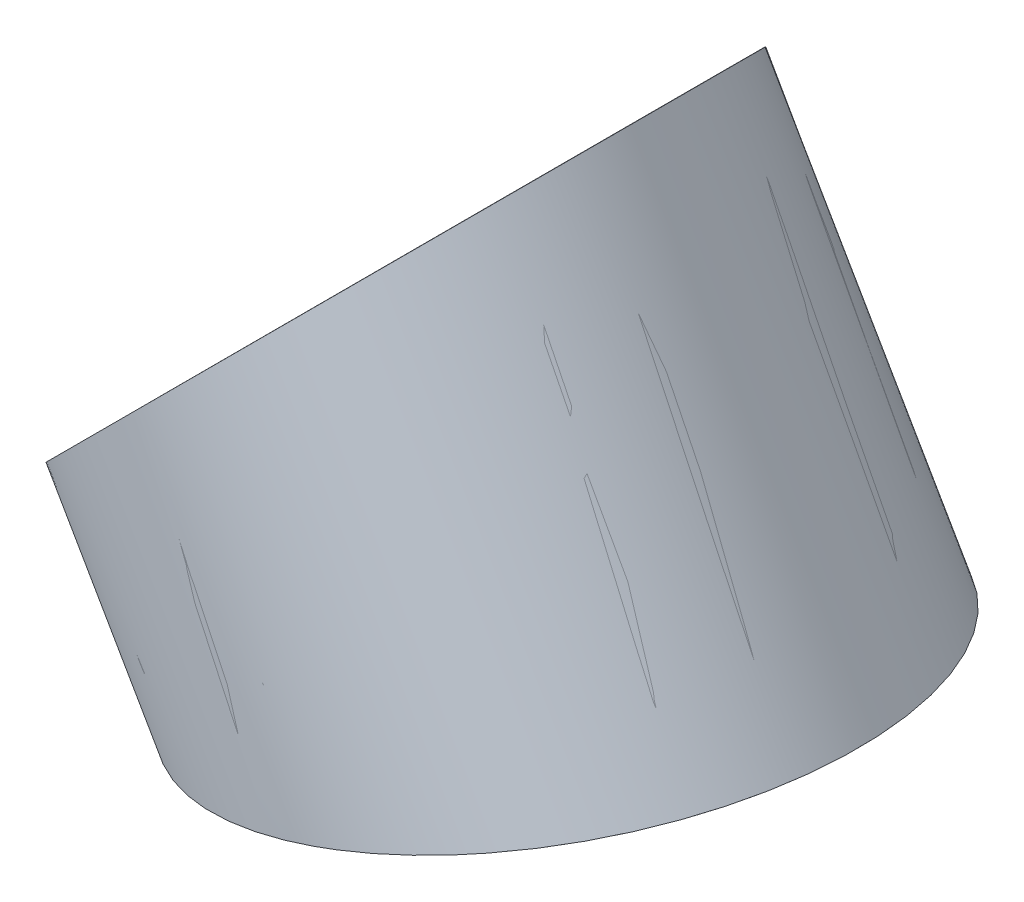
SolidWorks part; units mm, degrees
ref_plane "前视基准面" through (0, 0, 0) normal (0, 0, 1) x (1, 0, 0)
ref_plane "上视基准面" through (0, 0, 0) normal (0, 1, 0) x (1, 0, 0)
ref_plane "右视基准面" through (0, 0, 0) normal (1, 0, 0) x (0, 0, -1)
imported_body "基体零件-等径四节弯头-1"
sheet metal parameters "钣金1" parameters "D1"=0.7366, "厚度"=1
bend "圆角折弯1" bend radius 409 bend angle 359.86 parameters "D5"=1
flatten bends "展开-折弯1"
sketch "尖角-草图1" plane through (381.0514, 220.0002, -0.5) normal (-0.866, -0.5, -0.0012) x (-0.0011, -0.0006, 1)
  line L0 (-1284.4126, -117.8977) -> (-1284.4126, 117.8977) construction
  dimension "D1" = 0
process bends "加工-折弯1" parameters "D1"=0
sketch "平面-草图1" plane through (381.0514, 220.0002, -0.5) normal (-0.866, -0.5, -0.0012) x (-0.0011, -0.0006, 1)
